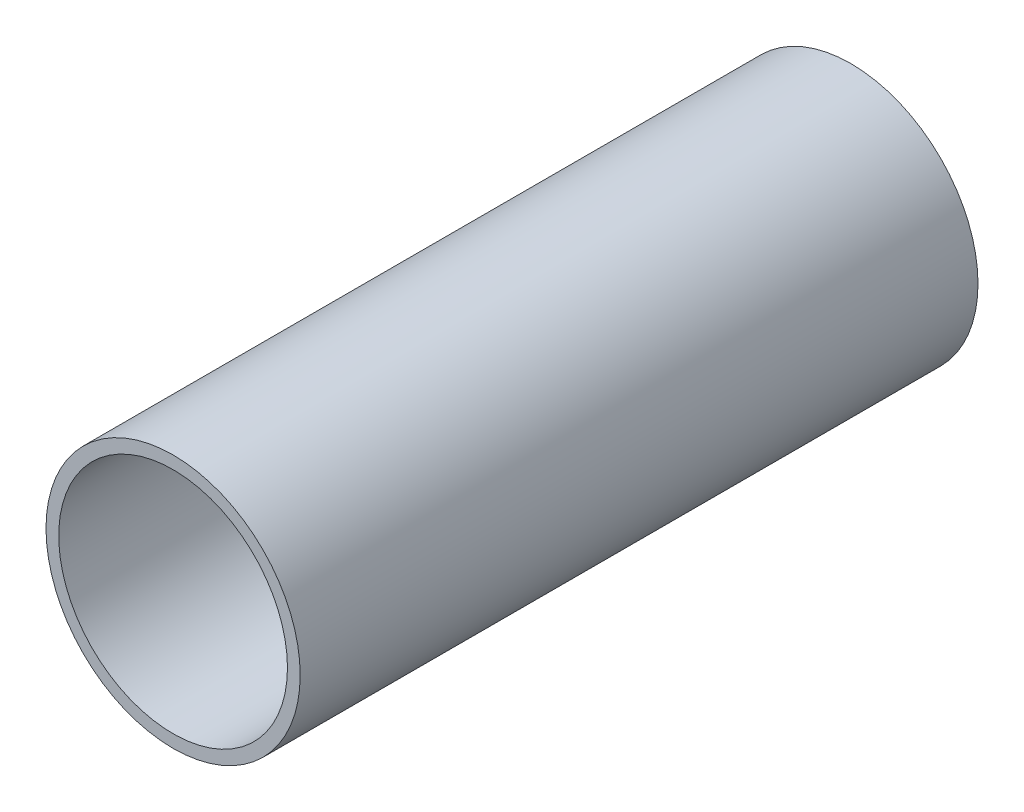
SolidWorks part; units mm, degrees
ref_plane "Plan de face" through (0, 0, 0) normal (0, 0, 1) x (1, 0, 0)
ref_plane "Plan de dessus" through (0, 0, 0) normal (0, 1, 0) x (1, 0, 0)
ref_plane "Plan de droite" through (0, 0, 0) normal (1, 0, 0) x (0, 0, -1)
sketch "Esquisse1" plane through (0, 0, 0) normal (0, 0, 1) x (1, 0, 0)
  circle A0 centre (0, 0) radius 15
  circle A1 centre (0, 0) radius 13.5
  dimension "D1" = 30
  dimension "D2" = 27
extrude "Extrusion1" add sketch "Esquisse1" along normal blind 80
